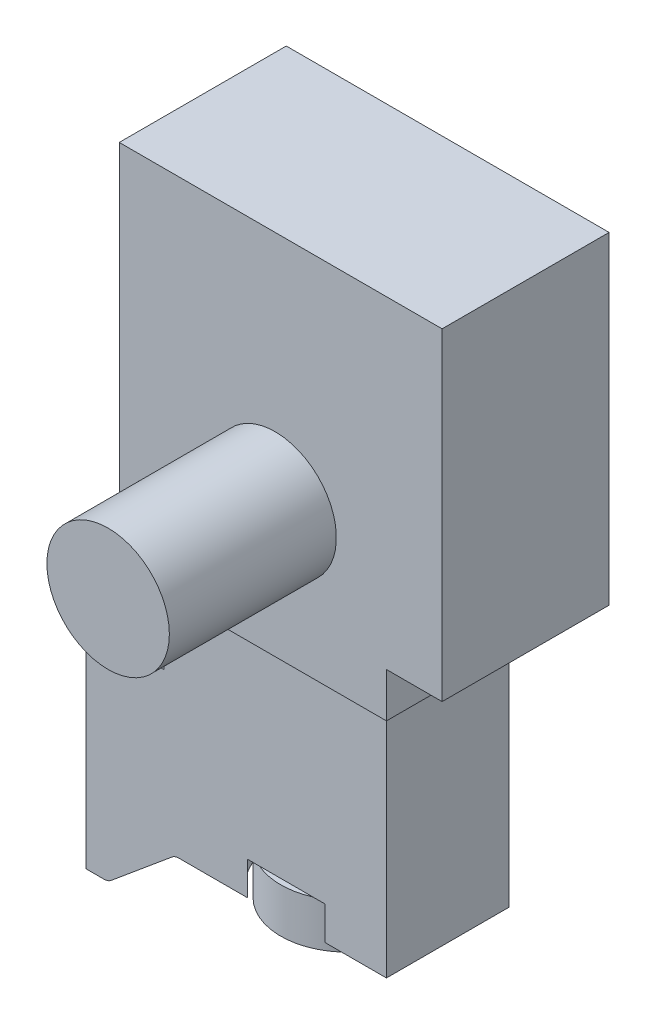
SolidWorks part; units mm, degrees
ref_plane "Plan1" through (0, 0, 0) normal (0, 0, 1) x (1, 0, 0)
ref_plane "Plan2" through (0, 0, 0) normal (0, 1, 0) x (1, 0, 0)
ref_plane "Plan3" through (0, 0, 0) normal (1, 0, 0) x (0, 0, -1)
sketch "Esquisse1" plane through (0, 0, 0) normal (0, 0, 1) x (1, 0, 0)
  line L0 (2.2781, 0.2318) -> (7.7219, 4.7682)
  line L1 (0, 0) -> (1.638, 0)
  line L2 (0, 0) -> (0, 19)
  line L3 (0, 19) -> (27, 19)
  line L4 (27, 5) -> (27, 19)
  line L5 (8.362, 5) -> (27, 5)
  arc A0 (8.362, 5) -> (7.7219, 4.7682) centre (8.362, 4) ccw
  arc A1 (1.638, 0) -> (2.2781, 0.2318) centre (1.638, 1) ccw
  point P9 (8, 5)
  point P12 (2, 0)
  dimension "D6" = 1
  dimension "D1" = 27
  dimension "D2" = 19
  dimension "D3" = 5
  dimension "D4" = 6
  dimension "D5" = 2
extrude "Base-Extrusion" add sketch "Esquisse1" along normal mid plane 11
sketch "Esquisse2" plane through (0, 19, 0) normal (0, 1, 0) x (-1, 0, 0)
  line L0 (-7, -5.5) -> (-7, 5.5)
  line L4 (-27, -5.5) -> (0, -5.5)
  line L5 (0, -5.5) -> (0, 5.5)
  line L6 (0, 5.5) -> (-27, 5.5)
  line L7 (-27, 5.5) -> (-27, -5.5)
  line L8 (-27, -5.5) -> (-7, -5.5)
  line L10 (-7, 5.5) -> (-27, 5.5)
  line L11 (-27, 5.5) -> (-27, -5.5)
  dimension "D2" = 20
  dimension "D1" = 0
extrude "Boss.-Extru.1" add sketch "Esquisse2" along normal blind 8
sketch "Esquisse3" plane through (0, 27, 0) normal (0, 1, 0) x (-1, 0, 0)
  line L8 (-29, 7.5) -> (-29, -7.5)
  line L9 (-29, -7.5) -> (-5, -7.5)
  line L10 (-5, -7.5) -> (-5, 7.5)
  line L11 (-5, 7.5) -> (-29, 7.5)
  line L12 (-29, 7.5) -> (-29, -7.5)
  line L13 (-29, -7.5) -> (-5, -7.5)
  line L14 (-5, -7.5) -> (-5, 7.5)
  line L15 (-5, 7.5) -> (-29, 7.5)
  dimension "D1" = 2
extrude "Boss.-Extru.2" add sketch "Esquisse3" along normal blind 4
sketch "Esquisse4" plane through (0, 31, 0) normal (0, 1, 0) x (-1, 0, 0)
  line L0 (-29, -7.5) -> (-5, -7.5) construction
  line L1 (-5, 7.5) -> (-29, 7.5) construction
  line L2 (-5, -7.5) -> (-5, 7.5) construction
  line L3 (-34, -7.5) -> (-5, -7.5)
  line L4 (-5, 7.5) -> (-34, 7.5)
  line L5 (-5, -7.5) -> (-5, 7.5)
  line L6 (-34, 7.5) -> (-34, -7.5)
  dimension "D1" = 29
extrude "Boss.-Extru.3" add sketch "Esquisse4" along normal blind 29
sketch "Esquisse5" plane through (0, 0, 7.5) normal (0, 0, 1) x (1, 0, 0)
  line L0 (5, 27) -> (29, 27) construction
  line L1 (34, 60) -> (34, 31) construction
  circle A0 centre (19, 39) radius 5.5
  dimension "D3" = 11
  dimension "D1" = 12
  dimension "D2" = 15
extrude "Boss.-Extru.4" add sketch "Esquisse5" along normal blind 15
sketch "Esquisse6" plane through (0, 5, 0) normal (0, -1, 0) x (1, 0, 0)
  line L0 (27, 5.5) -> (27, -5.5) construction
  circle A0 centre (18, 0) radius 6.5
  dimension "D2" = 13
  dimension "D1" = 9
extrude "Enlèv. mat.-Extru.1" cut sketch "Esquisse6" against normal blind 3
sketch "Esquisse7" plane through (0, 8, 0) normal (0, -1, 0) x (1, 0, 0)
  circle A0 centre (18, 0) radius 6
  dimension "D1" = 12
extrude "Boss.-Extru.5" add sketch "Esquisse7" along normal blind 4
